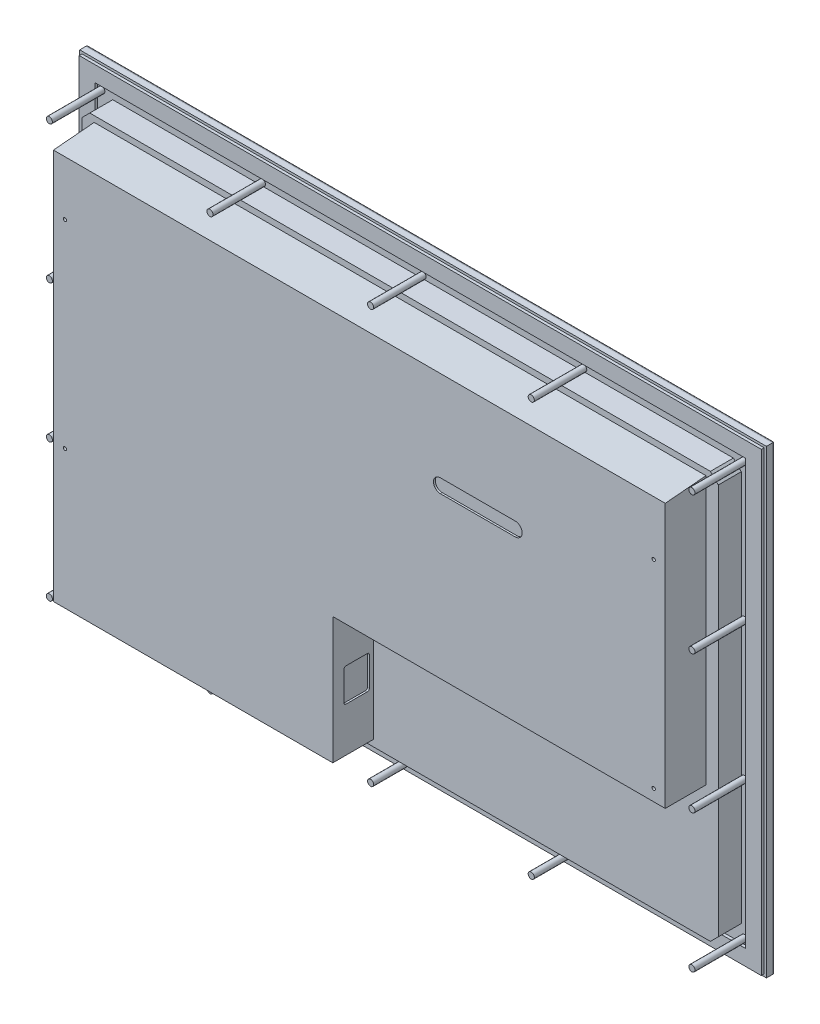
SolidWorks part; units mm, degrees
ref_plane "Front Plane" through (0, 0, 0) normal (0, 0, 1) x (1, 0, 0)
ref_plane "Top Plane" through (0, 0, 0) normal (0, 1, 0) x (1, 0, 0)
ref_plane "Right Plane" through (0, 0, 0) normal (1, 0, 0) x (0, 0, -1)
sketch "Sketch1" plane through (0, 0, 0) normal (0, 0, 1) x (1, 0, 0)
  line L0 (-279.4, 187.325) -> (279.4, 187.325)
  line L1 (279.4, 187.325) -> (279.4, -187.325)
  line L2 (279.4, -187.325) -> (-279.4, -187.325)
  line L3 (-279.4, -187.325) -> (-279.4, 187.325)
  point P2 (0, -187.325)
  point P3 (279.4, 0)
  dimension "D1" = 558.8
  dimension "D2" = 374.65
extrude "Bezel" add sketch "Sketch1" against normal blind 7.112
fillet "Bezel Radius" radius 2 4 edges at (0, -187.325, -7.112) (0, 187.325, -7.112) (-279.4, 0, -7.112) (279.4, 0, -7.112)
sketch "Sketch2" plane through (0, 0, -7.112) normal (0, 0, -1) x (-1, 0, 0)
  line L0 (-237.236, 148.336) -> (237.236, 148.336)
  line L1 (237.236, 148.336) -> (237.236, -148.336)
  line L2 (237.236, -148.336) -> (-237.236, -148.336)
  line L3 (-237.236, -148.336) -> (-237.236, 148.336)
  line L4 (277.4, 185.325) -> (-277.4, 185.325) construction
  line L5 (-277.4, 185.325) -> (-277.4, -185.325) construction
  point P0 (0, 148.336)
  point P6 (0, 185.325)
  point P8 (-237.236, 0)
  point P11 (-277.4, 0)
  dimension "D1" = 474.472
  dimension "D2" = 296.672
extrude "Window" cut sketch "Sketch2" against normal blind 2.35
sketch "Sketch3" plane through (0, 0, 0) normal (0, 0, 1) x (1, 0, 0)
  line L4 (-277.495, 185.42) -> (277.495, 185.42)
  line L5 (277.495, 185.42) -> (277.495, -185.42)
  line L6 (277.495, -185.42) -> (-277.495, -185.42)
  line L7 (-277.495, -185.42) -> (-277.495, 185.42)
  line L8 (279.4, 187.325) -> (-279.4, 187.325) construction
  line L9 (-279.4, 187.325) -> (-279.4, -187.325) construction
  line L10 (-279.4, -187.325) -> (279.4, -187.325) construction
  line L11 (279.4, -187.325) -> (279.4, 187.325) construction
  line L12 (-264.795, -172.72) -> (-264.795, 172.72)
  line L13 (-264.795, 172.72) -> (264.795, 172.72)
  line L14 (264.795, 172.72) -> (264.795, -172.72)
  line L15 (264.795, -172.72) -> (-264.795, -172.72)
  dimension "D1" = 1.905
  dimension "D2" = 1.905
  dimension "D3" = 1.905
  dimension "D4" = 1.905
  dimension "D5" = 12.7
extrude "Gasket" add sketch "Sketch3" along normal blind 2.3
sketch "Sketch5" plane through (0, 0, 0) normal (0, 0, 1) x (1, 0, 0)
  line L0 (-279.4, 187.325) -> (-279.4, -187.325) construction
  line L1 (279.4, 187.325) -> (-279.4, 187.325) construction
  circle A0 centre (-261.4168, 168.1226) radius 2.5
  circle A22 centre (-130.7084, 168.1226) radius 2.5
  circle A23 centre (-130.7084, -168.1226) radius 2.5
  circle A24 centre (0, 168.1226) radius 2.5
  circle A25 centre (0, -168.1226) radius 2.5
  circle A26 centre (130.7084, 168.1226) radius 2.5
  circle A27 centre (130.7084, -168.1226) radius 2.5
  circle A28 centre (261.4168, 168.1226) radius 2.5
  circle A29 centre (261.4168, -168.1226) radius 2.5
  circle A31 centre (-261.4168, -56.0578) radius 2.5
  circle A32 centre (-261.4168, -168.148) radius 2.5
  circle A33 centre (-261.4168, 56.0324) radius 2.5
  circle A34 centre (-261.4168, 56.0324) radius 2.5
  circle A35 centre (261.4168, 56.0324) radius 2.5
  circle A36 centre (-261.4168, -56.0578) radius 2.5
  circle A37 centre (261.4168, -56.0578) radius 2.5
  point P2 (0, 0)
  point P12 (0, 0)
  dimension "D1" = 5
  dimension "D2" = 17.9832
  dimension "D3" = 19.2024
  dimension "D4" = 3
  dimension "D5" = 130.7084
  dimension "D6" = 5
  dimension "D7" = 4
  dimension "D8" = 112.0902
extrude "Panel Frame Studs" add sketch "Sketch5" along normal blind 42.7
sketch "Sketch6" plane through (0, 0, 0) normal (0, 0, 1) x (1, 0, 0)
  line L0 (-258.9168, 159.2107) -> (-252.5049, 165.6226)
  line L1 (-252.5049, 165.6226) -> (252.5049, 165.6226)
  line L2 (252.5049, 165.6226) -> (258.9168, 159.2107)
  line L3 (258.9168, 159.2107) -> (258.9168, -159.2107)
  line L4 (258.9168, -159.2107) -> (252.5049, -165.6226)
  line L5 (252.5049, -165.6226) -> (-252.5049, -165.6226)
  line L6 (-252.5049, -165.6226) -> (-258.9168, -159.2107)
  line L7 (-258.9168, -159.2107) -> (-258.9168, 159.2107)
  circle A0 centre (-261.4168, 168.1226) radius 2.5 construction
  circle A6 centre (261.4168, 56.0324) radius 2.5 construction
  circle A7 centre (-130.7084, -168.1226) radius 2.5 construction
  point P12 (227.2176, 159.2107)
  dimension "D1" = 9.0678
  dimension "D2" = 45
extrude "Body" add sketch "Sketch6" along normal blind 18.7198 separate body
sketch "Sketch7" plane through (0, 0, 18.7198) normal (0, 0, 1) x (1, 0, 0)
  line L0 (-248.92, 160.782) -> (248.92, 160.782)
  line L1 (248.92, 160.782) -> (248.92, -57.15)
  line L2 (248.92, -57.15) -> (-21.59, -57.15)
  line L3 (-21.59, -57.15) -> (-21.59, -160.274)
  line L4 (-21.59, -160.274) -> (-248.92, -160.274)
  line L5 (-248.92, -160.274) -> (-248.92, 160.782)
  line L6 (-252.5049, -165.6226) -> (252.5049, -165.6226) construction
  line L7 (-279.4, -187.325) -> (279.4, -187.325) construction
  line L9 (-258.9168, 159.2107) -> (-258.9168, -159.2107) construction
  point P3 (0, 160.782)
  dimension "D1" = 497.84
  dimension "D2" = 217.932
  dimension "D3" = 270.51
  dimension "D4" = 103.124
  dimension "D5" = 27.051
extrude "Rear Cover" add sketch "Sketch7" along normal blind 33.147
draft "Rear Cover Slope" type of draft neutral plane draft angle 5 faces to draft 1 parameters "D1"=5
sketch "Sketch10" plane through (0, -57.15, 0) normal (0, 1, 0) x (1, 0, 0)
  line L0 (248.92, -51.8668) -> (248.92, -18.7198) construction
  line L1 (-21.59, -51.8668) -> (248.92, -51.8668) construction
  line L2 (248.92, -51.8668) -> (-248.92, -51.8668) construction
  line L3 (248.92, -51.8668) -> (248.92, -18.7198) construction
  line L53 (124.7533, -32.6459) -> (124.7533, -27.5659)
  line L54 (100.4773, -35.8184) -> (121.7053, -35.8184)
  line L55 (100.4773, -24.3935) -> (121.7053, -24.3935)
  line L56 (97.4293, -27.5659) -> (97.4293, -32.6459)
  line L57 (159.6583, -29.0772) -> (159.6583, -34.1572)
  line L58 (142.3863, -37.3297) -> (156.6103, -37.3297)
  line L59 (139.3383, -29.0772) -> (139.3383, -34.1572)
  line L60 (142.3863, -25.9048) -> (156.4827, -25.9022)
  line L61 (179.4357, -29.1026) -> (179.4357, -34.1826)
  line L62 (196.7077, -25.9302) -> (182.4837, -25.9302)
  line L63 (199.7557, -34.1826) -> (199.7557, -29.1026)
  line L64 (182.4837, -37.3551) -> (196.5801, -37.3576)
  line L65 (233.2031, -25.5339) -> (217.2011, -25.5339)
  line L66 (233.2031, -33.2174) -> (233.2031, -37.7259)
  line L67 (217.2011, -37.7259) -> (233.2031, -37.7259)
  line L68 (217.2011, -33.2174) -> (217.2011, -37.7259)
  line L69 (212.7561, -33.2174) -> (217.2011, -33.2174)
  line L70 (212.7561, -30.0424) -> (217.2011, -30.0424)
  line L71 (217.2011, -25.5339) -> (217.2011, -30.0424)
  line L72 (233.2031, -30.0424) -> (233.2031, -25.5339)
  line L73 (233.2031, -33.2174) -> (237.6481, -33.2174)
  line L74 (233.2031, -30.0424) -> (237.6481, -30.0424)
  circle A42 centre (127.3473, -30.1059) radius 1.5875
  arc A43 (124.7533, -32.6459) -> (121.7053, -35.8184) centre (121.5783, -32.6459) cw
  arc A44 (121.7053, -24.3935) -> (124.7533, -27.5659) centre (121.5783, -27.5659) cw
  arc A45 (97.4293, -27.5659) -> (100.4773, -24.3935) centre (100.6043, -27.5659) cw
  arc A46 (100.4773, -35.8184) -> (97.4293, -32.6459) centre (100.6043, -32.6459) cw
  circle A47 centre (94.8353, -30.1059) radius 1.5875
  arc A48 (142.3863, -37.3297) -> (139.3383, -34.1572) centre (142.5133, -34.1572) cw
  circle A49 centre (161.9983, -31.6299) radius 1.5875
  arc A50 (159.6583, -34.1572) -> (156.6103, -37.3297) centre (156.4833, -34.1572) cw
  circle A51 centre (136.9983, -31.6299) radius 1.5875
  arc A52 (139.3383, -29.0772) -> (142.3863, -25.9048) centre (142.5133, -29.0772) cw
  arc A53 (156.4827, -25.9022) -> (159.6583, -29.0772) centre (156.4833, -29.0772) cw
  circle A54 centre (177.0957, -31.6299) radius 1.5875
  arc A55 (179.4357, -29.1026) -> (182.4837, -25.9302) centre (182.6107, -29.1026) cw
  arc A56 (196.7077, -25.9302) -> (199.7557, -29.1026) centre (196.5807, -29.1026) cw
  arc A57 (199.7557, -34.1826) -> (196.5801, -37.3576) centre (196.5807, -34.1826) cw
  arc A58 (182.4837, -37.3551) -> (179.4357, -34.1826) centre (182.6107, -34.1826) cw
  circle A59 centre (202.0957, -31.6299) radius 1.5875
  arc A60 (212.7561, -33.2174) -> (212.7561, -30.0424) centre (212.7561, -31.6299) cw
  arc A61 (237.6481, -30.0424) -> (237.6481, -33.2174) centre (237.6481, -31.6299) cw
  dimension "D1" = 11.2719
  dimension "D2" = 20.2369
  dimension "D3" = 20.2369
  dimension "D4" = 86.9217
extrude "Video / Touch Interface" cut sketch "Sketch10" along normal blind 1.524 from surface at 0
sketch "Sketch11" plane through (-21.59, 0, 0) normal (-1, 0, 0) x (0, 0, 1)
  line L0 (51.8668, -160.274) -> (18.7198, -160.274) construction
  line L1 (51.8668, -160.274) -> (51.8668, -57.15) construction
  line L69 (22.1871, -98.7733) -> (22.1871, -122.7128)
  line L70 (23.7111, -97.2493) -> (41.1625, -97.2493)
  line L71 (42.685, -122.7128) -> (42.685, -98.7733)
  line L72 (41.161, -124.2368) -> (23.7096, -124.2368)
  arc A14 (23.7096, -124.2368) -> (22.1871, -122.7128) centre (23.7111, -122.7128) cw
  arc A15 (22.1871, -98.7733) -> (23.7111, -97.2493) centre (23.7111, -98.7733) cw
  arc A16 (41.1625, -97.2493) -> (42.685, -98.7733) centre (41.161, -98.7733) cw
  arc A17 (42.685, -122.7128) -> (41.161, -124.2368) centre (41.161, -122.7128) cw
  dimension "D1" = 36.0372
  dimension "D2" = 9.1818
extrude "Power AC Only" cut sketch "Sketch11" along normal blind 1.524 from surface at 0
sketch "Sketch12" plane through (0, 0, 51.8668) normal (0, 0, 1) x (1, 0, 0)
  line L0 (65.913, 73.1774) -> (126.873, 73.1774)
  line L1 (-279.4, 187.325) -> (-279.4, -187.325) construction
  line L2 (-279.4, -187.325) -> (279.4, -187.325) construction
  line L3 (65.913, 84.3534) -> (126.873, 84.3534)
  arc A6 (65.913, 84.3534) -> (65.913, 73.1774) centre (65.913, 78.7654) ccw
  arc A11 (126.873, 73.1774) -> (126.873, 84.3534) centre (126.873, 78.7654) ccw
  dimension "D4" = 5.588
  dimension "D1" = 266.0904
  dimension "D2" = 345.313
  dimension "D3" = 60.96
extrude "Controls Buttons" cut sketch "Sketch12" against normal blind 1.524 from surface at 0
hole_wizard "6-32 Accessory Bracket Holes" positions "Sketch13" profile "Sketch14" hole size "#6-32" standard "ANSI Inch"
sketch "Sketch13" plane through (0, 0, 51.8668) normal (0, 0, 1) x (1, 0, 0)
  line L0 (-279.4, 187.325) -> (-279.4, -187.325) construction
  line L1 (-279.4, -187.325) -> (279.4, -187.325) construction
  point P0 (-239.522, -47.752)
  point P2 (-239.522, 113.5888)
  point P4 (239.522, 113.5888)
  point P6 (239.522, -47.752)
  dimension "D1" = 161.3408
  dimension "D2" = 479.044
  dimension "D3" = 39.878
  dimension "D4" = 139.573
sketch "Sketch14" plane through (-239.522, -47.752, 51.8668) normal (1, 0, 0) x (0, -1, 0)
  line L0 (0, 0) -> (0, 16.8147)
  line L1 (0, 16.8147) -> (1.3525, 16.002)
  line L2 (1.3525, 16.002) -> (1.3525, 0)
  line L5 (1.3525, 0) -> (0, 0)
  line L10 (0, 16.8147) -> (-1.3526, 16.002) construction
  line L11 (0, -6.35) -> (0, 107.95) construction
  dimension "Hole Dia." = 2.7051
  dimension "Hole Depth" = 16.002
  dimension "Drill Angle" = 118
